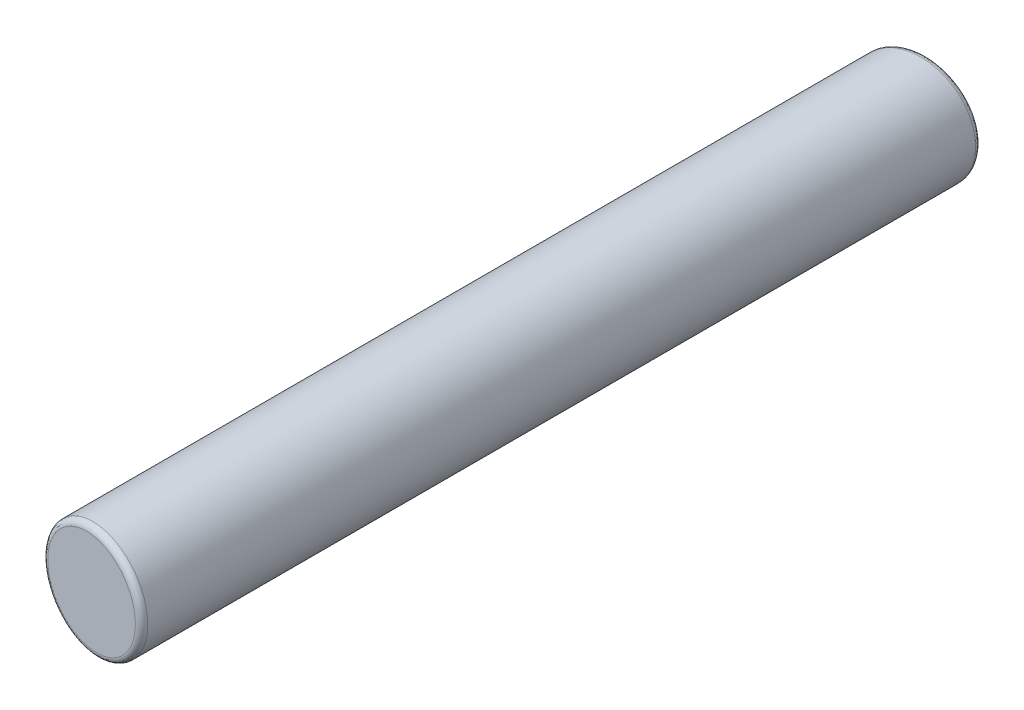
SolidWorks part; units mm, degrees
ref_plane "Front Plane" through (0, 0, 0) normal (0, 0, 1) x (1, 0, 0)
ref_plane "Top Plane" through (0, 0, 0) normal (0, 1, 0) x (1, 0, 0)
ref_plane "Right Plane" through (0, 0, 0) normal (1, 0, 0) x (0, 0, -1)
sketch "Sketch1" plane through (0, 0, 0) normal (0, 0, 1) x (1, 0, 0)
  circle A0 centre (0, 0) radius 1.2065
  dimension "D1" = 2.413
extrude "Boss-Extrude1" add sketch "Sketch1" along normal blind 18.2372
sketch "Sketch2" plane through (0, 0, 0) normal (0, 1, 0) x (1, 0, 0)
  line L0 (1.2065, -18.2372) -> (-1.452, -17.9175)
  line L1 (-1.452, -17.9175) -> (-1.1425, -18.4712)
  line L2 (-1.1425, -18.4712) -> (1.3005, -18.3898)
  line L3 (1.3005, -18.3898) -> (1.2065, -18.2372)
extrude "Cut-Extrude1" cut sketch "Sketch2" against normal mid plane 127
sketch "Sketch3" plane through (0, 0, 0) normal (0, 1, 0) x (1, 0, 0)
  line L2 (-1.2065, -0.2794) -> (1.2065, 0)
  line L5 (-1.6292, -0.2794) -> (-1.2065, -0.2794)
  line L6 (1.2065, 0) -> (1.2065, 0.4174)
  line L7 (1.2065, 0.4174) -> (-1.6292, 0.4174)
  line L8 (-1.6292, 0.4174) -> (-1.6292, -0.2794)
extrude "Cut-Extrude2" cut sketch "Sketch3" against normal mid plane 127
fillet "Fillet1" radius 0.127 2 edges at (-1.2065, 0, 17.947) (1.2065, 0, 0)
